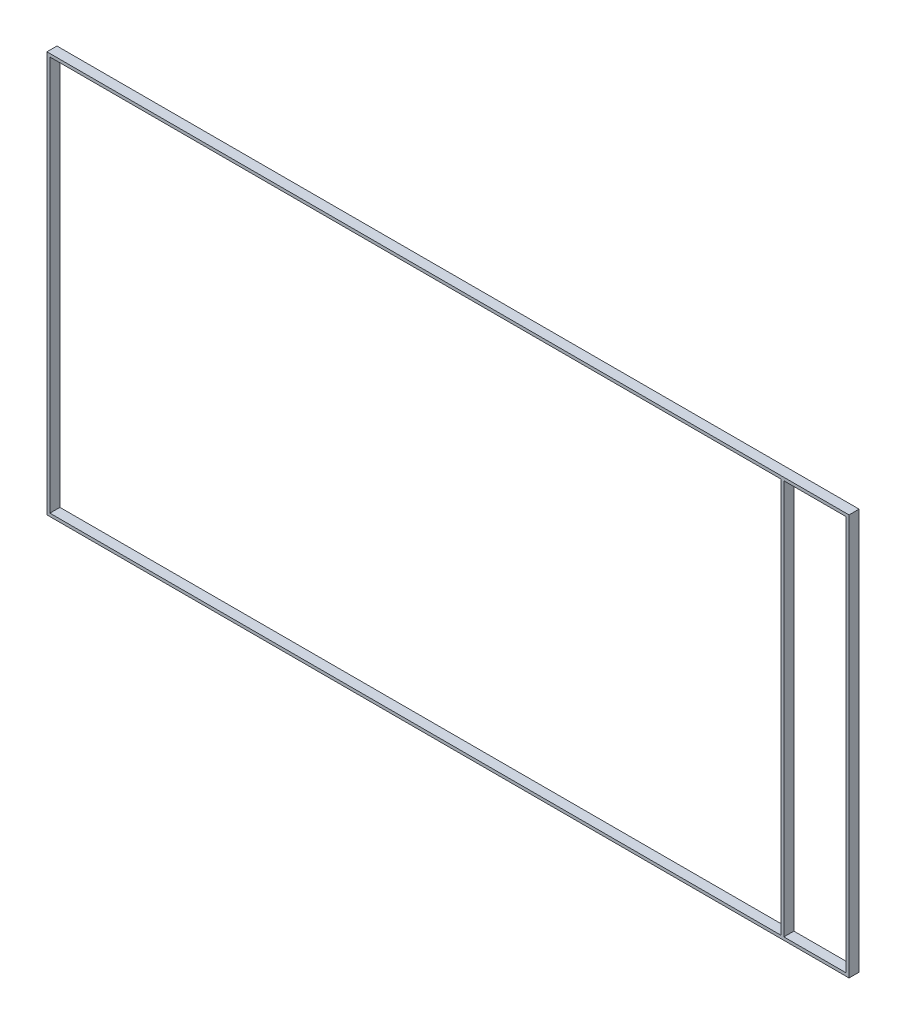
SolidWorks part; units mm, degrees
ref_plane "前视基准面" through (0, 0, 0) normal (0, 0, 1) x (1, 0, 0)
ref_plane "上视基准面" through (0, 0, 0) normal (0, 1, 0) x (1, 0, 0)
ref_plane "右视基准面" through (0, 0, 0) normal (1, 0, 0) x (0, 0, -1)
sketch "草图1" plane through (0, 0, 0) normal (0, 0, 1) x (1, 0, 0)
  line L0 (-1985, 985) -> (1660, 985)
  line L1 (-2000, 1000) -> (2000, 1000)
  line L2 (-2000, 1000) -> (-2000, -1000)
  line L3 (-2000, -1000) -> (2000, -1000)
  line L4 (2000, 1000) -> (2000, -1000)
  line L5 (-2000, 1000) -> (2000, -1000) construction
  line L6 (-2000, -1000) -> (2000, 1000) construction
  line L7 (1985, 985) -> (1985, -985)
  line L8 (-1985, -985) -> (1660, -985)
  line L9 (-1985, 985) -> (-1985, -985)
  line L10 (1667.5, 985) -> (1667.5, -985) construction
  line L11 (1660, 985) -> (1660, -985)
  line L12 (1675, 985) -> (1675, -985)
  line L13 (1675, -985) -> (1985, -985)
  line L14 (1675, 985) -> (1985, 985)
  line L15 (-1985, -985) -> (1985, -985) construction
  line L17 (-1985, 985) -> (1985, 985) construction
  point P0 (0, 0)
  dimension "D1" = 2000
  dimension "D2" = 4000
  dimension "D4" = 317.5
  dimension "D3" = 15
  dimension "D5" = 7.5
  dimension "D6" = 7.5
extrude "凸台-拉伸1" add sketch "草图1" along normal blind 50
